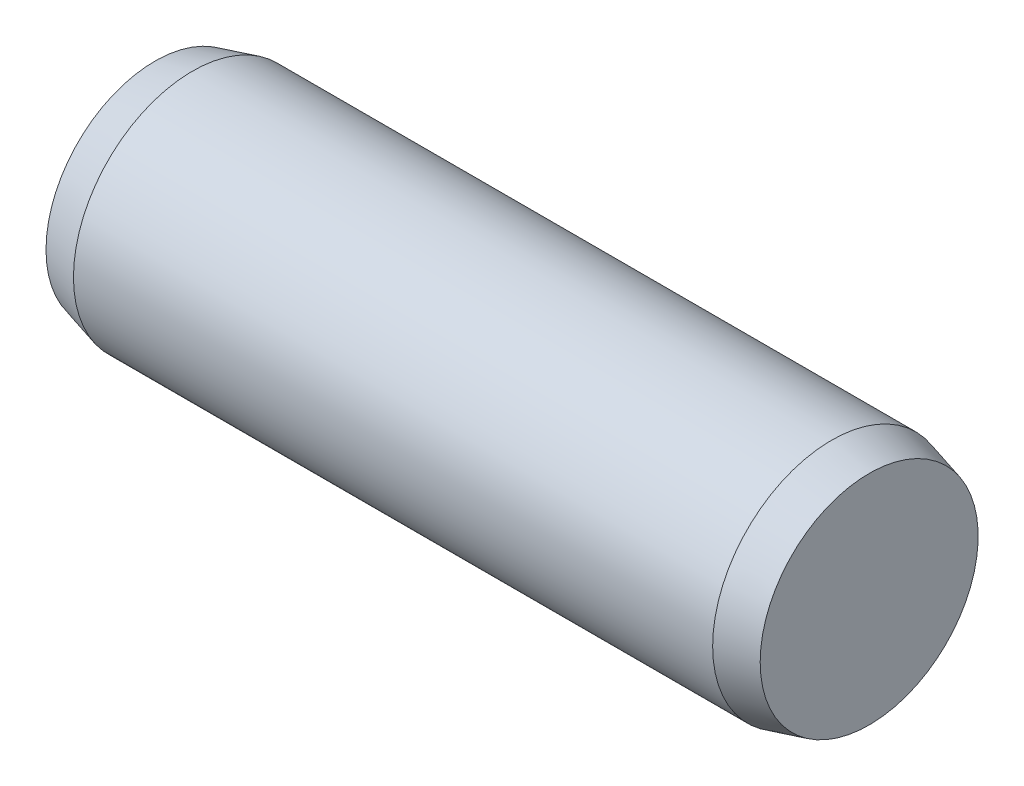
SolidWorks part; units mm, degrees
ref_plane "Plane1" through (0, 0, 0) normal (0, 0, 1) x (1, 0, 0)
ref_plane "Plane2" through (0, 0, 0) normal (0, 1, 0) x (1, 0, 0)
ref_plane "Plane3" through (0, 0, 0) normal (1, 0, 0) x (0, 0, -1)
sketch "Sketch1" plane through (0, 0, 0) normal (0, 0, 1) x (1, 0, 0)
  line L1 (-6.35, 0) -> (107.95, 0) construction
  line L2 (0, 0) -> (12, 0)
  line L3 (12, 0) -> (12, 1.8312)
  line L4 (12, 1.8312) -> (11.37, 2)
  line L5 (11.37, 2) -> (0.63, 2)
  line L6 (0, 1.8312) -> (0, 0)
  line L7 (0, 1.8312) -> (0.63, 2)
revolve "Base-Revolve" add sketch "Sketch1" angle 360 about L1
equation "\"D3@Sketch1\" = 15.0"
equation "\"D1@Sketch1\" = \"Chamfer_len@Sketch1\""
equation "\"D2@Sketch1\" = \"D3@Sketch1\""
